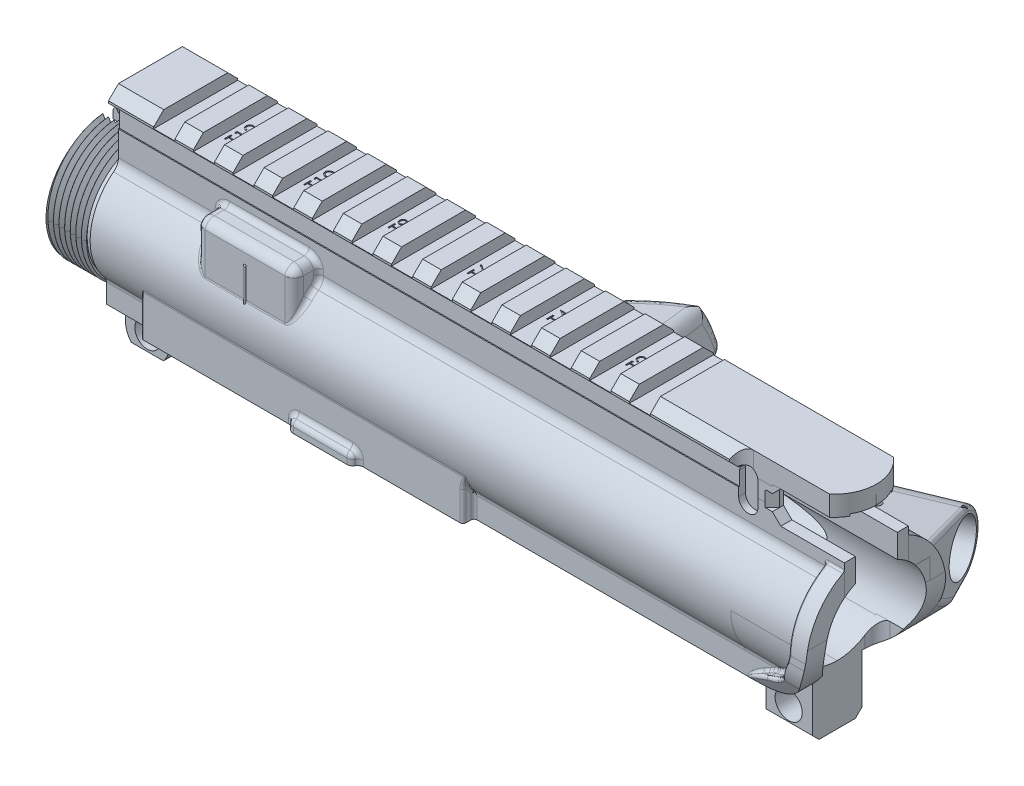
SolidWorks part; units mm, degrees
ref_plane "Front Plane" through (0, 0, 0) normal (0, 0, 1) x (1, 0, 0)
ref_plane "Top Plane" through (0, 0, 0) normal (0, 1, 0) x (1, 0, 0)
ref_plane "Right Plane" through (0, 0, 0) normal (1, 0, 0) x (0, 0, -1)
imported_body "Imported1"
sketch "Sketch2" plane through (0, 0, 14.2875) normal (0, 0, 1) x (1, 0, 0)
  line L1 (36.7663, -2.8738) -> (68.7707, -2.8738)
  line L2 (36.7663, -2.8738) -> (36.7663, 10.7038)
  line L3 (36.7663, 10.7038) -> (68.7707, 10.7038)
  line L4 (68.7707, -2.8738) -> (68.7707, 10.7038)
extrude "Cut-Extrude1" cut sketch "Sketch2" along normal blind 2.54
sketch "Sketch1" plane through (0, 0, 14.2875) normal (0, 0, 1) x (1, 0, 0)
  line L3 (61.468, 9.3472) -> (61.468, 6.35)
  line L4 (44.8056, 9.3472) -> (61.468, 9.3472)
  line L5 (44.8056, 6.35) -> (44.8056, 9.3472)
  line L6 (44.8056, 6.35) -> (61.468, 6.35)
  line L7 (86.9696, 6.35) -> (7.0734, 6.35) construction
  line L8 (87.7316, 12.0526) -> (87.7316, 6.35) construction
  dimension "D1" = 2.9972
  dimension "D2" = 16.6624
  dimension "D3" = 26.2636
extrude "Boss-Extrude1" add sketch "Sketch1" along normal blind 1.524
fillet "Fillet1" radius 1.5748 2 edges at (44.8056, 9.3472, 15.0495) (61.468, 9.3472, 15.0495)
fillet "Fillet2" radius 1.5748 5 edges at (61.468, 7.0612, 15.8115) (61.0068, 8.886, 15.8115) (44.8056, 7.0612, 15.8115) (45.2668, 8.886, 15.8115) (53.1368, 9.3472, 15.8115)
fillet "Fillet3" radius 1.5748 5 edges at (44.8056, 7.0612, 14.2875) (45.2668, 8.886, 14.2875) (53.1368, 9.3472, 14.2875) (61.0068, 8.886, 14.2875) (61.468, 7.0612, 14.2875)
sketch "Sketch3" plane through (0, 0, 14.2444) normal (0, 0, 1) x (1, 0, 0)
  line L0 (32.6072, 38.2016) -> (32.6072, 25.536) construction
  line L1 (42.672, 38.2016) -> (22.5425, 38.2016) construction
  line L2 (32.2897, 35.3441) -> (32.2897, 25.536)
  line L3 (32.9247, 35.3441) -> (32.9247, 25.536)
  line L4 (32.2897, 25.536) -> (32.9247, 25.536)
  line L5 (32.9247, 38.2016) -> (32.9247, 25.536) construction
  line L6 (32.2897, 38.2016) -> (32.2897, 25.536) construction
  arc A0 (32.9247, 35.3441) -> (32.2897, 35.3441) centre (32.6072, 35.3441) ccw
  point P9 (32.6072, 35.6616)
  dimension "D3" = 2.54
  dimension "D1" = 0.3175
  dimension "D2" = 0.3175
extrude "Boss-Extrude2" add sketch "Sketch3" along normal blind 0.254
fillet "Fillet4" radius 0.254 3 edges at (32.2897, 31.1834, 14.4984) (32.6072, 35.6616, 14.4984) (32.9247, 31.1834, 14.4984)
sketch "Sketch4" plane through (0, 50.165, 0) normal (0, 1, 0) x (1, 0, 0)
  line L0 (20.1993, -5.1191) -> (20.1993, 5.1191) construction
  line L1 (16.2751, 0) -> (20.9486, 0) construction
  line L5 (30.2069, -5.1191) -> (30.2069, 5.1191) construction
  line L6 (40.2145, -5.1191) -> (40.2145, 5.1191) construction
  line L7 (50.2221, -5.1191) -> (50.2221, 5.1191) construction
  line L8 (60.2297, -5.1191) -> (60.2297, 5.1191) construction
  line L9 (70.2373, -5.1191) -> (70.2373, 5.1191) construction
  line L10 (80.2449, -5.1191) -> (80.2449, 5.1191) construction
  line L11 (90.2525, -5.1191) -> (90.2525, 5.1191) construction
  line L12 (100.2601, -5.1191) -> (100.2601, 5.1191) construction
  line L13 (110.2677, -5.1191) -> (110.2677, 5.1191) construction
  line L14 (120.2753, -5.1191) -> (120.2753, 5.1191) construction
  line L15 (130.2829, -5.1191) -> (130.2829, 5.1191) construction
  text T0 " T12" font "Century Gothic" height 3.175
  text T1 " T10" font "Century Gothic" height 3.175
  text T2 "  T8" font "Century Gothic" height 3.175
  text T3 "  T6" font "Century Gothic" height 3.175
  text T4 "  T4" font "Century Gothic" height 3.175
  text T5 "  T2" font "Century Gothic" height 3.175
  point P8 (20.1993, 0)
  point P9 (18.6118, 0)
  dimension "D1" = 1.5875
  dimension "D2" = 12
extrude "Cut-Extrude2" cut sketch "Sketch4" against normal blind 0.254
